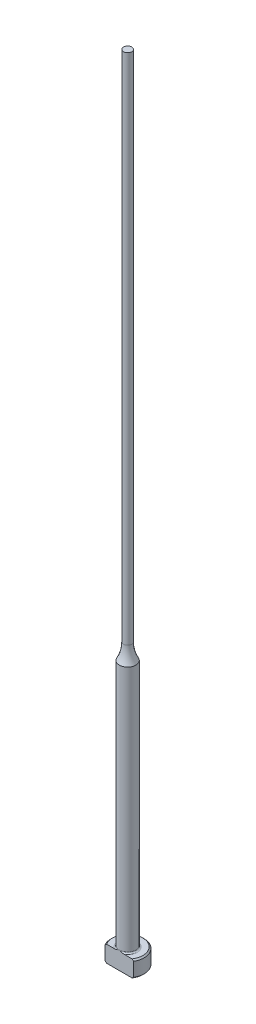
SolidWorks part; units mm, degrees
ref_plane "Front Plane" through (0, 0, 0) normal (0, 0, 1) x (1, 0, 0)
ref_plane "Top Plane" through (0, 0, 0) normal (0, 1, 0) x (1, 0, 0)
ref_plane "Right Plane" through (0, 0, 0) normal (1, 0, 0) x (0, 0, -1)
sketch "Sketch1" plane through (0, 0, 0) normal (0, 0, 1) x (1, 0, 0)
  line L0 (0, 259.9588) -> (0, -15.1925) construction
  line L1 (0, 0) -> (-3.175, 0)
  line L2 (-3.175, 0) -> (-3.175, 3.175)
  line L3 (-3.175, 3.175) -> (-1.5875, 3.175)
  line L4 (-0.7937, 53.8742) -> (-0.7937, 152.4)
  line L5 (-0.7937, 152.4) -> (0, 152.4)
  line L6 (0, 152.4) -> (0, 0)
  line L7 (-1.5875, 3.175) -> (-1.5875, 50.8)
  arc A0 (-1.5875, 50.8) -> (-0.7937, 53.8742) centre (-7.1437, 53.8742) ccw
  point P13 (-1.5875, 0)
  dimension "D1" = 6.35
  dimension "L" = 152.4
  dimension "D2" = 3.175
  dimension "H" = 6.35
  dimension "T" = 3.175
  dimension "D" = 1.5875
  dimension "S" = 50.8
revolve "Revolve1" add sketch "Sketch1" angle 360 about L0
chamfer "Chamfer1" distance 0.254 angle 45 2 edges at (0, 3.175, 3.175) (0, 0, 3.175)
fillet "Fillet1" radius 0.254 1 edges at (0, 3.175, 1.5875)
sketch "Sketch2" plane through (0, 0, 0) normal (0, -1, 0) x (1, 0, 0)
  line L0 (-2.7496, 1.5875) -> (2.7496, 1.5875)
  circle A0 centre (0, 0) radius 3.175 construction
  arc A1 (2.7496, 1.5875) -> (-2.7496, 1.5875) centre (0, 0) ccw
  circle A4 centre (0, 0) radius 1.5875 construction
  dimension "D1" = 0
extrude "KEY" cut sketch "Sketch2" against normal through all
